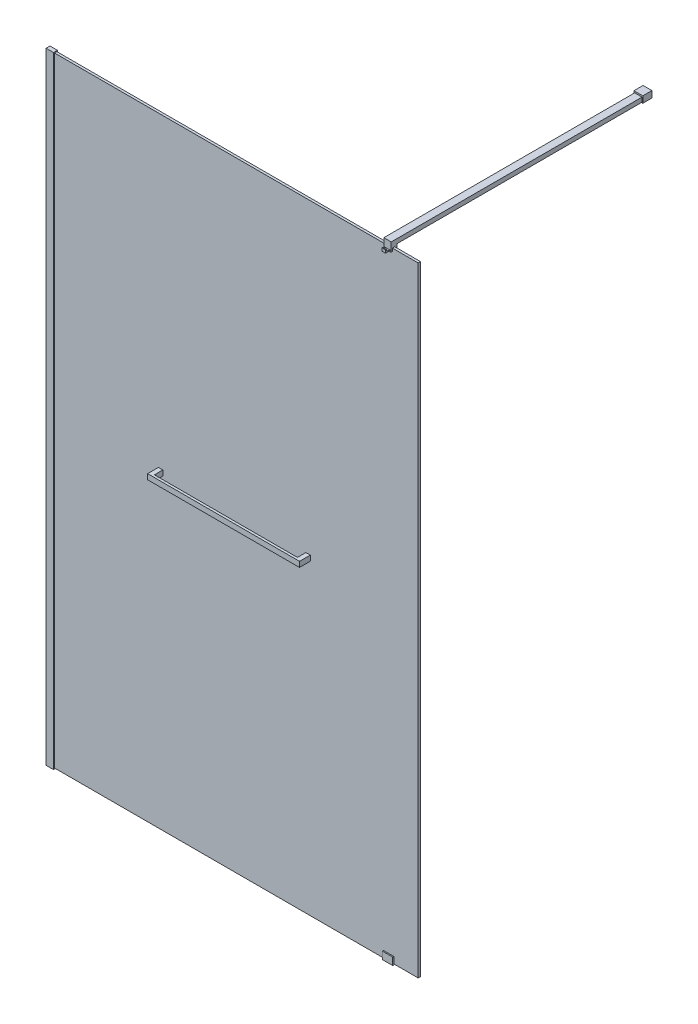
SolidWorks part; units mm, degrees
ref_plane "Płaszczyzna przednia" through (0, 0, 0) normal (0, 0, 1) x (1, 0, 0)
ref_plane "Płaszczyzna górna" through (0, 0, 0) normal (0, 1, 0) x (1, 0, 0)
ref_plane "Płaszczyzna prawa" through (0, 0, 0) normal (1, 0, 0) x (0, 0, -1)
sketch "Szkic1" plane through (0, 0, 0) normal (0, 1, 0) x (1, 0, 0)
  line L0 (0, 0) -> (0, 13.3)
  line L2 (0, 13.3) -> (25, 13.3)
  line L3 (25, 13.3) -> (25, 11.4)
  line L4 (25, 11.4) -> (11.45, 11.4)
  line L5 (11.45, 11.4) -> (11.45, 3.4)
  line L6 (11.45, 3.4) -> (25, 3.4)
  line L7 (25, 3.4) -> (25, 0)
  line L8 (25, 0) -> (0, 0)
  dimension "D1" = 13.3
  dimension "D4" = 1.9
  dimension "D5" = 8
  dimension "D6" = 3.4
  dimension "D7" = 13.55
  dimension "D8" = 25
extrude "Dodanie-wyciągnięcie1" add sketch "Szkic1" along normal blind 2100
sketch "Szkic2" plane through (0, 0, 0) normal (0, -1, 0) x (1, 0, 0)
  line L0 (11.45, -3.4) -> (1258.45, -3.4)
  line L1 (11.45, -3.4) -> (11.45, -11.4)
  line L2 (1258.45, -3.4) -> (1258.45, -11.4)
  line L3 (11.45, -11.4) -> (1258.45, -11.4)
  line L4 (11.45, -11.4) -> (25, -11.4) construction
  dimension "D1" = 1247
extrude "Dodanie-wyciągnięcie2" add sketch "Szkic2" against normal blind 2100 separate body
sketch "Szkic4" plane through (0, 2100, 0) normal (0, 1, 0) x (1, 0, 0)
  line L1 (25, 13.3) -> (0, 13.3) construction
  line L2 (25, 11.4) -> (25, 13.3) construction
  line L3 (0, 13.3) -> (0, 0) construction
  line L5 (0, 0) -> (25, 0) construction
  line L7 (25, 13.3) -> (0, 13.3)
  line L8 (25, 0) -> (25, 13.3)
  line L9 (0, 13.3) -> (0, 0)
  line L11 (0, 0) -> (25, 0)
extrude "Dodanie-wyciągnięcie3" add sketch "Szkic4" along normal blind 3
sketch "Szkic5" plane through (0, 0, 0) normal (0, -1, 0) x (1, 0, 0)
  line L1 (0, 0) -> (25, 0) construction
  line L2 (25, 0) -> (25, -3.4) construction
  line L3 (0, -13.3) -> (0, 0) construction
  line L5 (25, -13.3) -> (0, -13.3) construction
  line L7 (0, 0) -> (25, 0)
  line L8 (25, 0) -> (25, -13.3)
  line L9 (0, -13.3) -> (0, 0)
  line L11 (25, -13.3) -> (0, -13.3)
extrude "Dodanie-wyciągnięcie4" add sketch "Szkic5" along normal blind 3
ref_plane "Płaszczyzna1" through (1158.45, 0, 0) normal (1, 0, 0) x (0, 0, -1)
sketch "Szkic6" plane through (1158.45, 0, 0) normal (1, 0, 0) x (0, 0, -1)
  line L0 (11.4, 22) -> (15.75, 22)
  line L1 (15.75, 22) -> (15.75, -3)
  line L2 (15.75, -3) -> (-0.35, -3)
  line L3 (-0.35, -3) -> (-0.35, 22)
  line L4 (-0.35, 22) -> (3.4, 22)
  line L5 (11.4, 22) -> (11.4, 0)
  line L6 (11.4, 0) -> (11.4, 2100)
  line L7 (11.4, 0) -> (11.4, 2100) construction
  line L8 (3.4, 2100) -> (3.4, 0)
  line L9 (3.4, 2100) -> (3.4, 0) construction
  line L10 (11.4, 0) -> (3.4, 0)
  line L11 (3.4, 0) -> (3.4, 22)
  dimension "D1" = 4.35
  dimension "D2" = 25
  dimension "D3" = 3
  dimension "D4" = 3.75
extrude "Dodanie-wyciągnięcie5" add sketch "Szkic6" along normal mid plane 35 separate body
sketch "Szkic7" plane through (1158.45, 0, 0) normal (1, 0, 0) x (0, 0, -1)
  line L0 (3.4, 2100) -> (3.4, 0) construction
  line L1 (-0.6, 2120) -> (19.4, 2120)
  line L2 (3.4, 2100) -> (3.4, 0) construction
  line L4 (11.4, 2100) -> (3.4, 2100) construction
  line L13 (11.4, 2100) -> (11.4, 0) construction
  line L20 (19.4, 2120) -> (19.4, 2090)
  line L25 (19.4, 2090) -> (11.4, 2090)
  line L26 (11.4, 2090) -> (11.4, 2100)
  line L27 (11.4, 2100) -> (3.4, 2100)
  line L28 (3.4, 2100) -> (3.4, 2090)
  line L29 (3.4, 2090) -> (-13.37, 2090)
  line L30 (-13.37, 2090) -> (-13.37, 2100)
  line L31 (-13.37, 2100) -> (-10.37, 2100)
  line L32 (-10.37, 2100) -> (-9.8451, 2094)
  line L33 (-9.8451, 2094) -> (-0.6, 2094)
  line L34 (-0.6, 2094) -> (-0.6, 2120)
  dimension "D3" = 20
  dimension "D4" = 30
  dimension "D5" = 16.77
  dimension "D6" = 4
  dimension "D14" = 8
  dimension "D21" = 10
  dimension "D22" = 4
  dimension "D23" = 3
  dimension "D24" = 95
extrude "Dodanie-wyciągnięcie6" add sketch "Szkic7" along normal mid plane 25 separate body
sketch "Szkic8" plane through (0, 2100, 0) normal (0, 1, 0) x (1, 0, 0)
  line L0 (1145.95, -0.6) -> (1152.45, -3.631)
  line L1 (1152.45, -3.631) -> (1152.45, -13.37)
  line L2 (1170.95, -0.6) -> (1164.45, -3.631)
  line L3 (1164.45, -3.631) -> (1164.45, -13.37)
  line L4 (1158.45, -10.37) -> (1158.45, 156.6902) construction
  line L5 (1170.95, -10.37) -> (1145.95, -10.37) construction
  line L6 (1152.45, -13.37) -> (1164.45, -13.37)
  line L7 (1170.95, -13.37) -> (1145.95, -13.37) construction
  dimension "D1" = 12
  dimension "D2" = 115
extrude "Wytnij-wyciągnięcie1" cut sketch "Szkic8" against normal through all and the other way through all
sketch "Szkic10" plane through (0, 2120, 0) normal (0, 1, 0) x (1, 0, 0)
  line L0 (1158.45, 31.9) -> (1158.45, 19.4) construction
  line L1 (1145.95, 881.03) -> (1170.95, 881.03)
  line L2 (1145.95, 881.03) -> (1145.95, 19.4)
  line L3 (1145.95, 19.4) -> (1170.95, 19.4)
  line L4 (1170.95, 19.4) -> (1145.95, 19.4) construction
  line L5 (1145.95, 19.4) -> (1145.95, -0.6) construction
  line L6 (1170.95, 881.03) -> (1170.95, 19.4)
  point P4 (1158.45, 31.9)
  dimension "D2" = 861.63
  dimension "D1" = 25
  dimension "D3" = 12.5
extrude "Dodanie-wyciągnięcie7" add sketch "Szkic10" against normal blind 15
sketch "Szkic14" plane through (0, 0, -881.03) normal (0, 0, -1) x (-1, 0, 0)
  line L1 (-1173.45, 2125) -> (-1143.45, 2125)
  line L2 (-1173.45, 2125) -> (-1173.45, 2103)
  line L3 (-1173.45, 2103) -> (-1143.45, 2103)
  line L4 (-1143.45, 2125) -> (-1143.45, 2103)
  line L5 (-1173.45, 2125) -> (-1143.45, 2103) construction
  line L6 (-1173.45, 2103) -> (-1143.45, 2125) construction
  line L7 (-1158.45, 2120) -> (-1158.45, 2114) construction
  line L8 (-1170.95, 2120) -> (-1145.95, 2120) construction
  line L9 (-1170.95, 2105) -> (-1145.95, 2105) construction
  point P0 (-1158.45, 2114)
  dimension "D1" = 30
  dimension "D2" = 22
  dimension "D3" = 2
extrude "Dodanie-wyciągnięcie8" add sketch "Szkic14" against normal blind 31
sketch "Szkic17" plane through (0, 0, -3.4) normal (0, 0, 1) x (1, 0, 0)
  line L0 (634.95, 2100) -> (634.95, 1050) construction
  line L1 (1258.45, 2100) -> (11.45, 2100) construction
  line L2 (634.95, 1050) -> (634.95, 0) construction
  line L3 (1258.45, 0) -> (11.45, 0) construction
  line L4 (384.95, 1050) -> (884.95, 1050) construction
  line L6 (377.45, 1059) -> (392.45, 1059)
  line L7 (377.45, 1059) -> (377.45, 1041)
  line L8 (377.45, 1041) -> (392.45, 1041)
  line L9 (392.45, 1059) -> (392.45, 1041)
  line L10 (377.45, 1059) -> (392.45, 1041) construction
  line L11 (377.45, 1041) -> (392.45, 1059) construction
  line L12 (877.45, 1059) -> (892.45, 1059)
  line L13 (877.45, 1059) -> (877.45, 1041)
  line L14 (877.45, 1041) -> (892.45, 1041)
  line L15 (892.45, 1059) -> (892.45, 1041)
  line L16 (877.45, 1059) -> (892.45, 1041) construction
  line L17 (877.45, 1041) -> (892.45, 1059) construction
  dimension "D1" = 500
  dimension "D2" = 15
  dimension "D3" = 18
extrude "polka_1a" add sketch "Szkic17" along normal blind 36.5 and the other way blind 31 separate body
sketch "Szkic18" plane through (377.45, 0, 0) normal (-1, 0, 0) x (0, 0, 1)
  line L0 (-34.4, 1059) -> (-34.4, 1041) construction
  line L1 (-34.4, 1053.73) -> (-21.6, 1053.73)
  line L2 (-34.4, 1053.73) -> (-34.4, 1045.73)
  line L3 (-34.4, 1045.73) -> (-21.6, 1045.73)
  line L4 (-21.6, 1053.73) -> (-21.6, 1045.73)
  line L5 (-34.4, 1041) -> (33.1, 1041) construction
  dimension "D1" = 4.73
  dimension "D2" = 8
  dimension "D3" = 12.8
extrude "polka_1b" cut sketch "Szkic18" against normal up to surface (515 mm away)
sketch "Szkic19" plane through (0, 1059, 0) normal (0, 1, 0) x (1, 0, 0)
  line L0 (892.45, 21.6) -> (377.45, 21.6)
  line L1 (892.45, 21.6) -> (892.45, 101.6)
  line L2 (377.45, 21.6) -> (377.45, 101.6)
  line L3 (892.45, 101.6) -> (377.45, 101.6)
  line L4 (892.45, 34.4) -> (892.45, -33.1) construction
  line L5 (377.45, 34.4) -> (377.45, -33.1) construction
  line L6 (11.45, 11.4) -> (1258.45, 11.4) construction
  dimension "D1" = 10.2
  dimension "D2" = 80
extrude "polka_1c" add sketch "Szkic19" against normal blind 8 from offset 5.28 separate body
sketch "Szkic20" plane through (392.45, 0, 0) normal (1, 0, 0) x (0, 0, -1)
  line L0 (34.4, 1041) -> (-33.1, 1041) construction
  line L1 (-33.1, 1059) -> (-25.1, 1059)
  line L2 (-33.1, 1059) -> (-33.1, 1041)
  line L3 (-33.1, 1041) -> (-25.1, 1041)
  line L4 (-25.1, 1059) -> (-25.1, 1041)
  dimension "D1" = 8
extrude "polka_1d" add sketch "Szkic20" along normal up to surface (485 mm away)
